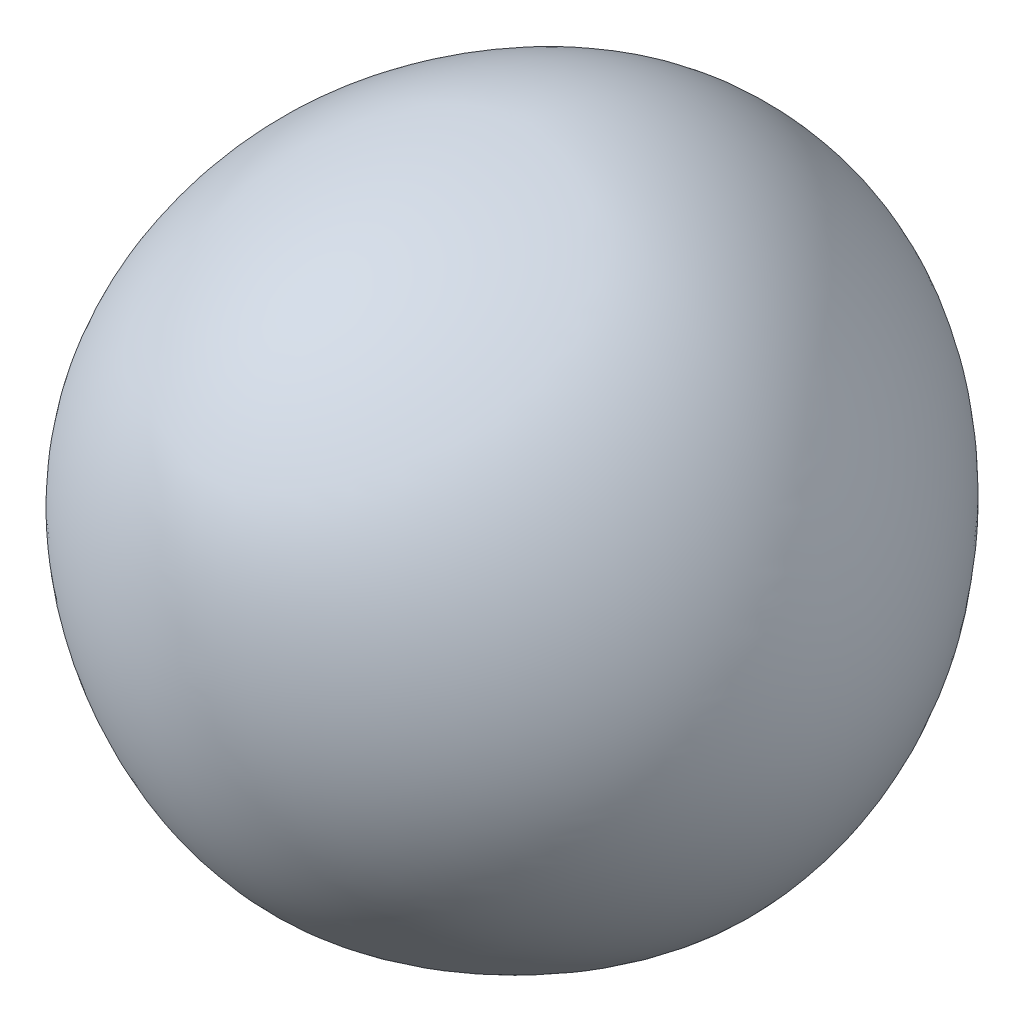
SolidWorks part; units mm, degrees
ref_plane "Front Plane" through (0, 0, 0) normal (0, 0, 1) x (1, 0, 0)
ref_plane "Top Plane" through (0, 0, 0) normal (0, 1, 0) x (1, 0, 0)
ref_plane "Right Plane" through (0, 0, 0) normal (1, 0, 0) x (0, 0, -1)
sketch "Sketch1" plane through (0, 0, 0) normal (0, 0, 1) x (1, 0, 0)
  line L0 (0, 0) -> (0, 65.8122) construction
  line L1 (0, 0) -> (15, 0) construction
  line L2 (0, 65.8122) -> (43.3882, 14.1042) construction
  line L3 (0, 133.3122) -> (39.6517, 133.3122) construction
  line L4 (-17.886, 133.3122) -> (18.0972, 133.3122) construction
  circle A0 centre (0, 65.8122) radius 67.5 construction
  arc A2 (15, 0) -> (43.3882, 14.1042) centre (0, 65.8122) ccw
  spline S0 degree 3 poles (43.3882, 14.1042) (53.4759, 22.5689) (75.4094, 52.1475) (54.4078, 115.8704) (22.4895, 133.3122) (0, 133.3122) knots 0 0 0 0 0.335535 0.618909 1 1 1 1
  dimension "D2" = 135
  dimension "D1" = 15
  dimension "D3" = 40
sketch "Sketch2" plane through (0, 0, 0) normal (0, 0, 1) x (1, 0, 0)
  line L0 (0, 65.8122) -> (-43.3882, 14.1042) construction
  line L1 (0, 0) -> (0, 65.8122) construction
  line L2 (0, 0) -> (-15, 0) construction
  line L3 (0, 133.3122) -> (-72.1917, 133.3122) construction
  circle A0 centre (0, 65.8122) radius 67.5 construction
  arc A1 (-15, 0) -> (-43.3882, 14.1042) centre (0, 65.8122) cw
  spline S0 degree 3 poles (0, 133.3122) (-35.0282, 133.3122) (-87.8623, 68.3984) (-59.6445, 27.7449) (-43.3882, 14.1042) knots 0 0 0 0 0.549947 1 1 1 1
  dimension "D1" = 40
sketch "Sketch3" plane through (0, 0, 0) normal (1, 0, 0) x (0, 0, -1)
  line L0 (0, 0) -> (15, 0) construction
  line L1 (0, 65.8122) -> (43.3882, 14.1042) construction
  line L2 (0, 133.3122) -> (0, -1.6878) construction
  circle A0 centre (0, 65.8122) radius 67.5 construction
  arc A1 (15, 0) -> (43.3882, 14.1042) centre (0, 65.8122) ccw
  spline S0 degree 3 poles (0, 133.3122) (22.5878, 133.3122) (54.5253, 114.2453) (71.44, 83.5679) (68.9036, 49.3417) (59.6438, 27.7443) (43.3882, 14.1042) knots 0 0 0 0 0.343973 0.659628 0.725231 1 1 1 1
  dimension "D1" = 40
sketch "Sketch4" plane through (0, 0, 0) normal (1, 0, 0) x (0, 0, -1)
  line L0 (0, 0) -> (-15, 0) construction
  line L1 (0, 65.8122) -> (-43.3882, 14.1042) construction
  line L2 (0, 133.3122) -> (0, -1.6878) construction
  line L3 (0, 133.3122) -> (-60.7384, 133.3122) construction
  line L4 (-37.264, 133.3122) -> (37.264, 133.3122) construction
  circle A1 centre (0, 65.8122) radius 67.5 construction
  arc A2 (-15, 0) -> (-43.3882, 14.1042) centre (0, 65.8122) cw
  spline S0 degree 3 poles (0, 133.3122) (-30.038, 133.3122) (-62.0567, 118.3633) (-70.0636, 60.1167) (-62.3745, 30.0356) (-43.3882, 14.1042) knots 0 0 0 0 0.545626 0.645626 1 1 1 1
  dimension "D1" = 40
other "Boundary-Surface1"
surface "Surface-Offset1" parameters "D1"=3.5
surface "Surface-Fill1"
surface "Surface-Knit1"
sketch "Sketch6" plane through (0, 0, 0) normal (0, 0, 1) x (1, 0, 0)
  line L0 (0, 0) -> (0, 7.5422) construction
  line L1 (0, 0) -> (0, -4.9934)
  line L6 (0, -4.9934) -> (15, -4.9934)
  line L7 (15, -4.9934) -> (15, 12.2276)
  line L8 (15, 12.2276) -> (0, 12.2276)
  line L9 (0, 12.2276) -> (0, 0)
  dimension "D1" = 15
revolve "Cut-Revolve2" cut sketch "Sketch6" angle 360 about L0
